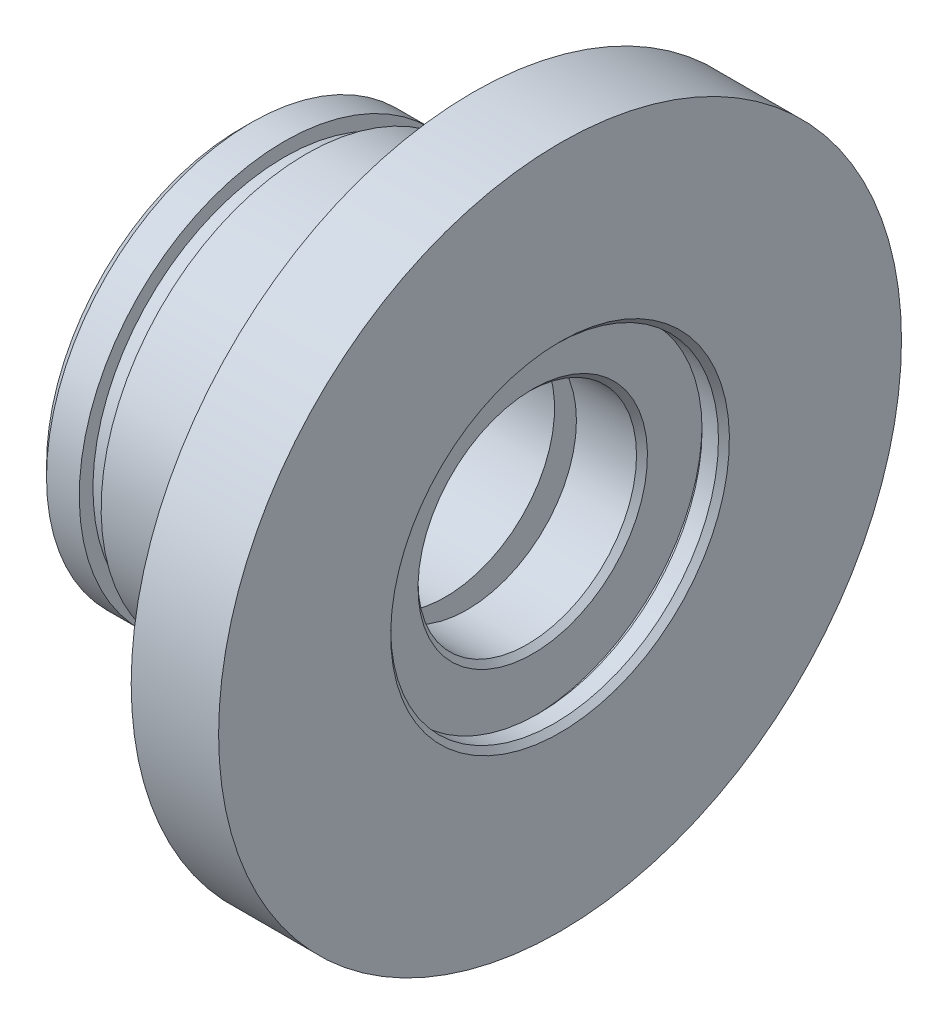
SolidWorks part; units mm, degrees
ref_plane "Płaszczyzna przednia" through (0, 0, 0) normal (0, 0, 1) x (1, 0, 0)
ref_plane "Płaszczyzna górna" through (0, 0, 0) normal (0, 1, 0) x (1, 0, 0)
ref_plane "Płaszczyzna prawa" through (0, 0, 0) normal (1, 0, 0) x (0, 0, -1)
sketch "Szkic1" plane through (0, 0, 0) normal (0, 0, 1) x (1, 0, 0)
  line L0 (0, 0) -> (-61.9141, 0) construction
  line L1 (-75.185, 75) -> (-75.185, 55)
  line L2 (-75.185, 55) -> (-50.185, 55)
  line L3 (-50.185, 40) -> (-0.185, 40)
  line L4 (-0.185, 40) -> (-0.185, 54)
  line L5 (-0.185, 54) -> (7.815, 54)
  line L6 (7.815, 54) -> (7.815, 40)
  line L7 (7.815, 40) -> (31.815, 40)
  line L8 (31.815, 40) -> (31.815, 62)
  line L9 (31.815, 62) -> (33.815, 62)
  line L10 (33.815, 62) -> (33.815, 60)
  line L11 (33.815, 60) -> (41.815, 60)
  line L12 (41.815, 60) -> (41.815, 125)
  line L13 (41.815, 125) -> (9.815, 125)
  line L14 (9.815, 125) -> (9.815, 75)
  line L15 (9.815, 75) -> (-51.185, 75)
  line L16 (-50.185, 55) -> (-50.185, 40)
  line L17 (-59.185, 75) -> (-75.185, 75)
  line L19 (-59.185, 75) -> (-59.185, 70)
  line L20 (-59.185, 70) -> (-51.185, 70)
  line L21 (-51.185, 75) -> (-51.185, 70)
  dimension "D1" = 25
  dimension "D2" = 50
  dimension "D3" = 8
  dimension "D4" = 24
  dimension "D5" = 2
  dimension "D6" = 8
  dimension "D7" = 32
  dimension "D8" = 110
  dimension "D9" = 80
  dimension "D10" = 108
  dimension "D11" = 150
  dimension "D12" = 250
  dimension "D13" = 80
  dimension "D14" = 124
  dimension "D15" = 120
  dimension "D16" = 140
  dimension "D17" = 16
  dimension "D18" = 8
revolve "Obrót1" add sketch "Szkic1" angle 360 about L0
fillet "Zaokrąglenie1" radius 10 1 edges at (9.815, 75, 0)
chamfer "Sfazowanie1" distance 4 angle 45 1 edges at (-75.185, 75, 0)
chamfer "Sfazowanie2" distance 4 angle 45 1 edges at (-75.185, 55, 0)
chamfer "Sfazowanie3" distance 2 angle 45 1 edges at (31.815, 40, 0)
chamfer "Sfazowanie4" distance 2 angle 45 1 edges at (41.815, 60, 0)
sketch "Szkic2" plane through (-50.185, 0, 0) normal (-1, 0, 0) x (0, 0, 1)
  line L1 (-8, 27.6726) -> (8, 27.6726)
  line L2 (-8, 27.6726) -> (-8, 52)
  line L3 (-8, 52) -> (8, 52)
  line L4 (8, 27.6726) -> (8, 52)
  circle A0 centre (0, 0) radius 40 construction
  dimension "D1" = 16
  dimension "D2" = 8
  dimension "D3" = 92
extrude "Wytnij-wyciągnięcie1" cut sketch "Szkic2" against normal up to next
